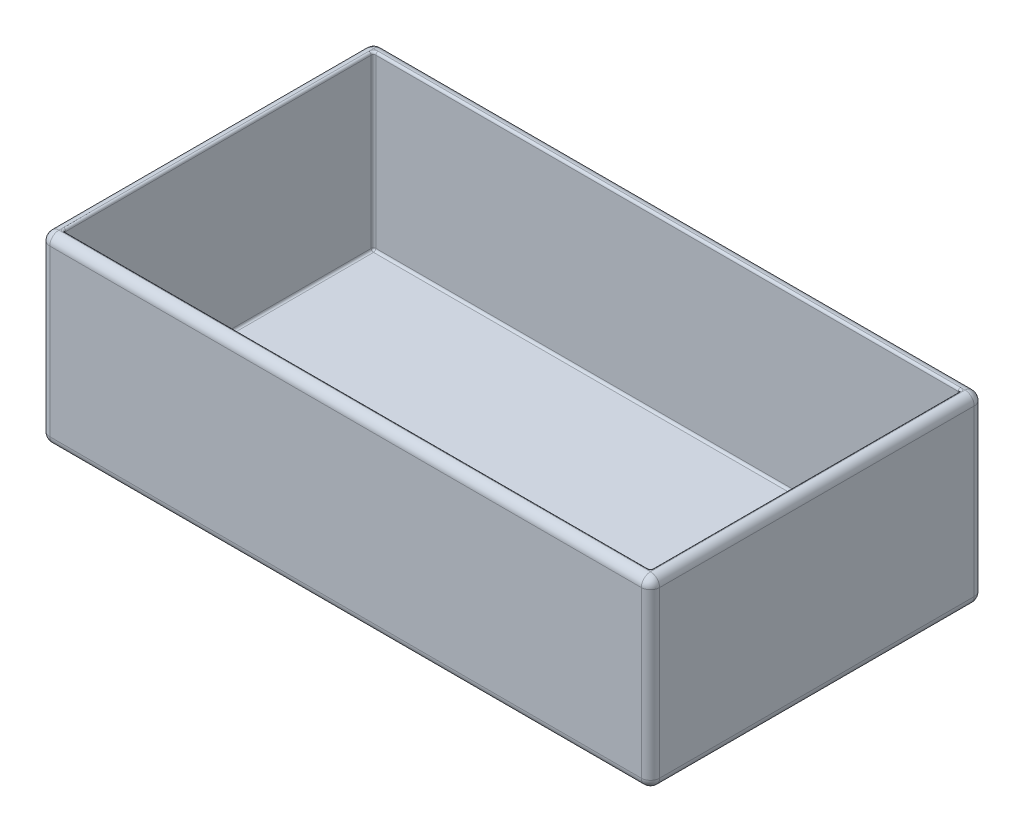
SolidWorks part; units mm, degrees
ref_plane "Front Plane" through (0, 0, 0) normal (0, 0, 1) x (1, 0, 0)
ref_plane "Top Plane" through (0, 0, 0) normal (0, 1, 0) x (1, 0, 0)
ref_plane "Right Plane" through (0, 0, 0) normal (1, 0, 0) x (0, 0, -1)
sketch "Sketch1" plane through (0, 0, 0) normal (0, 1, 0) x (1, 0, 0)
  line L1 (-168.91, 92.202) -> (168.91, 92.202)
  line L2 (-168.91, 92.202) -> (-168.91, -92.202)
  line L3 (-168.91, -92.202) -> (168.91, -92.202)
  line L4 (168.91, 92.202) -> (168.91, -92.202)
  line L5 (-168.91, 92.202) -> (168.91, -92.202) construction
  line L6 (-168.91, -92.202) -> (168.91, 92.202) construction
  point P0 (0, 0)
  dimension "D1" = 337.82
  dimension "D2" = 184.404
extrude "Boss-Extrude1" add sketch "Sketch1" along normal blind 101.6
shell "Shell1" thickness 6.35
fillet "Fillet1" radius 5.08 12 edges at (0, 101.6, -92.202) (0, 0, -92.202) (168.91, 101.6, 0) (168.91, 50.8, -92.202) (168.91, 0, 0) (0, 101.6, 92.202) (168.91, 50.8, 92.202) (0, 0, 92.202) (-168.91, 50.8, -92.202) (-168.91, 101.6, 0) (-168.91, 50.8, 92.202) (-168.91, 0, 0)
fillet "Fillet2" radius 1.27 12 edges at (0, 101.6, 85.852) (162.56, 101.6, 0) (162.56, 53.975, 85.852) (0, 101.6, -85.852) (162.56, 53.975, -85.852) (0, 6.35, 85.852) (0, 6.35, -85.852) (162.56, 6.35, 0) (-162.56, 53.975, 85.852) (-162.56, 101.6, 0) (-162.56, 53.975, -85.852) (-162.56, 6.35, 0)
